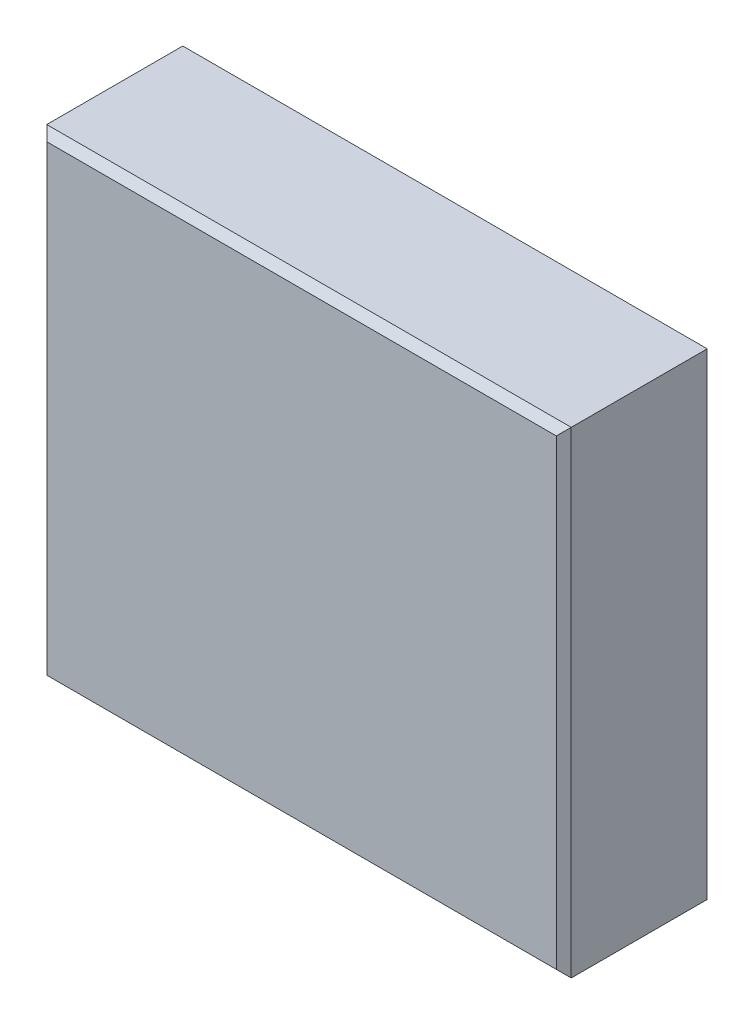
SolidWorks part; units mm, degrees
ref_plane "Plan de face" through (0, 0, 0) normal (0, 0, 1) x (1, 0, 0)
ref_plane "Plan de dessus" through (0, 0, 0) normal (0, 1, 0) x (1, 0, 0)
ref_plane "Plan de droite" through (0, 0, 0) normal (1, 0, 0) x (0, 0, -1)
sketch "Esquisse2" plane through (0, 0, 0) normal (0, 0, 1) x (1, 0, 0)
  line L0 (-201.9114, -61.7722) -> (-201.9114, -120.5063) construction
  line L1 (150, 150) -> (-201.9114, 150)
  line L2 (150, 150) -> (150, -170)
  line L3 (150, -170) -> (-201.9114, -170)
  line L4 (-201.9114, 150) -> (-201.9114, -170)
  dimension "D1" = 150
  dimension "D2" = 150
  dimension "D3" = 170
extrude "Extrusion1" add sketch "Esquisse2" along normal up to surface (101.2658 mm away)
other "Empreinte1"
other "NOYAU<1>@Assemblage11"
chamfer "Chanfrein2" distance 5 angle 45 9 edges at (150, -10, 101.2658) (-25.9557, 150, 101.2658) (-201.9114, -10, 101.2658) (-25.9557, -170, 101.2658) (-201.9114, -145.2532, 0) (-201.9114, 44.1139, 0) (-25.9557, -170, 0) (-25.9557, 150, 0) (150, -10, 0)
